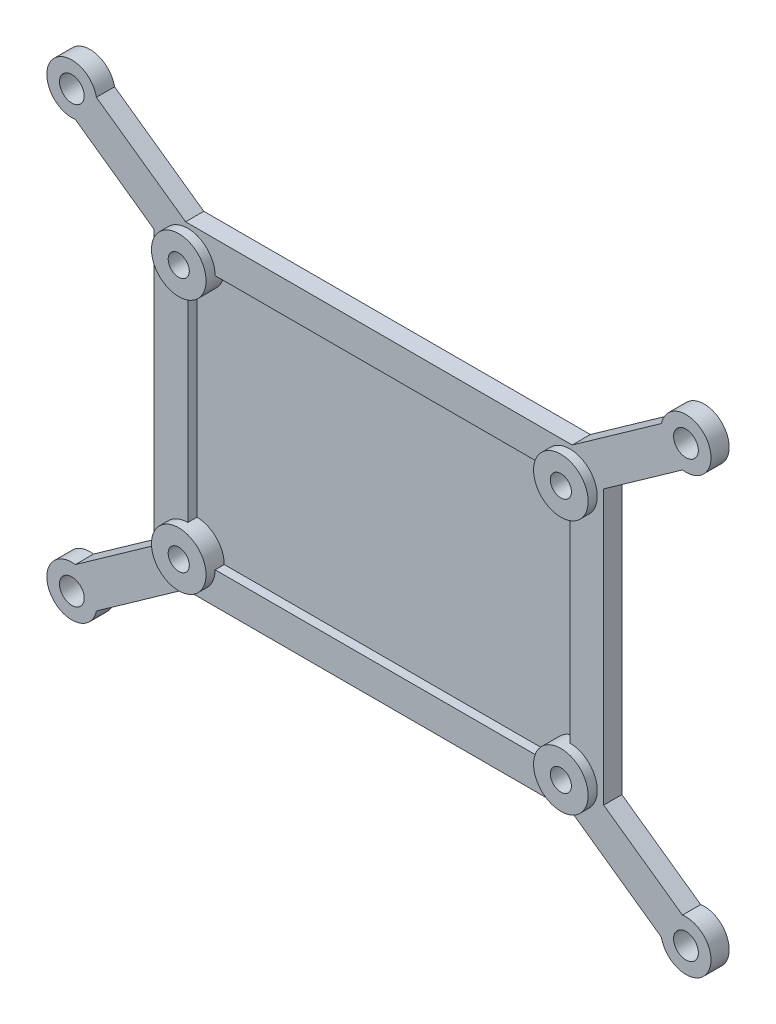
SolidWorks part; units mm, degrees
ref_plane "Front Plane" through (0, 0, 0) normal (0, 0, 1) x (1, 0, 0)
ref_plane "Top Plane" through (0, 0, 0) normal (0, 1, 0) x (1, 0, 0)
ref_plane "Right Plane" through (0, 0, 0) normal (1, 0, 0) x (0, 0, -1)
sketch "Sketch1" plane through (0, 0, 0) normal (0, 0, 1) x (1, 0, 0)
  line L0 (-42.8625, 30.3625) -> (42.8625, -30.3625) construction
  line L1 (42.8625, 30.3625) -> (-42.8625, -30.3625) construction
  line L2 (39.4382, 31.0496) -> (26.9807, 22.225)
  line L3 (-42.3747, 26.9042) -> (-31.3749, 19.1123)
  line L4 (42.3747, 26.9042) -> (31.3749, 19.1123)
  line L5 (-39.4382, 31.0496) -> (-26.9807, 22.225)
  line L6 (-44.3307, 28.2898) -> (41.3943, -32.4352) construction
  line L7 (-41.3943, 32.4352) -> (44.3307, -28.2898) construction
  line L8 (41.3943, 32.4352) -> (-44.3307, -28.2898) construction
  line L9 (44.3307, 28.2898) -> (-41.3943, -32.4352) construction
  line L10 (-31.3749, -19.1123) -> (-42.3747, -26.9042)
  line L11 (26.9807, -22.225) -> (39.4382, -31.0496)
  line L12 (31.3749, -19.1123) -> (42.3747, -26.9042)
  line L13 (-26.9807, -22.225) -> (-39.4382, -31.0496)
  line L15 (26.9807, -22.225) -> (-26.9807, -22.225)
  line L16 (31.3749, -19.1123) -> (31.3749, 19.1123)
  line L17 (26.9807, 22.225) -> (-26.9807, 22.225)
  line L18 (-31.3749, -19.1123) -> (-31.3749, 19.1123)
  line L19 (31.3749, -22.225) -> (-31.3749, 22.225) construction
  line L20 (31.3749, 22.225) -> (-31.3749, -22.225) construction
  arc A0 (-39.4382, 31.0496) -> (-42.3747, 26.9042) centre (-42.8625, 30.3625) ccw
  arc A1 (42.3747, 26.9042) -> (39.4382, 31.0496) centre (42.8625, 30.3625) ccw
  arc A2 (-42.3747, -26.9042) -> (-39.4382, -31.0496) centre (-42.8625, -30.3625) ccw
  arc A3 (39.4382, -31.0496) -> (42.3747, -26.9042) centre (42.8625, -30.3625) ccw
  circle A4 centre (-42.8625, 30.3625) radius 3.4925 construction
  point P26 (0, 0)
  dimension "D3" = 44.45
  dimension "D1" = 2.54
  dimension "D2" = 2.54
extrude "Boss-Extrude1" add sketch "Sketch1" along normal blind 2.54
hole_wizard "#4 Clearance Hole1" positions "Sketch3" profile "Sketch2" hole size "#4" standard "ANSI Inch"
sketch "Sketch3" plane through (0, 0, 2.54) normal (0, 0, 1) x (1, 0, 0)
  point P0 (-42.8625, 30.3625)
  point P3 (42.8625, 30.3625)
  point P6 (-42.8625, -30.3625)
  point P9 (42.8625, -30.3625)
sketch "Sketch2" plane through (-42.8625, 30.3625, 2.54) normal (1, 0, 0) x (0, -1, 0)
  line L0 (0, 0) -> (0, 7.3878)
  line L1 (0, 7.3878) -> (1.7272, 6.35)
  line L2 (1.7272, 6.35) -> (1.7272, 0)
  line L5 (1.7272, 0) -> (0, 0)
  line L10 (0, 7.3878) -> (-1.7272, 6.35) construction
  line L11 (0, -6.35) -> (0, 107.95) construction
  dimension "Hole Dia." = 3.4544
  dimension "Hole Depth" = 6.35
  dimension "Drill Angle" = 118
sketch "Sketch4" plane through (0, 0, 2.54) normal (0, 0, 1) x (1, 0, 0)
  line L5 (-26.67, 17.78) -> (26.67, 17.78) construction
  line L6 (-26.67, 17.78) -> (-26.67, -17.78) construction
  line L7 (-26.67, -17.78) -> (26.67, -17.78) construction
  line L8 (26.67, 17.78) -> (26.67, -17.78) construction
  circle A0 centre (-26.67, 17.78) radius 3.81
  circle A1 centre (-26.67, -17.78) radius 3.81
  circle A2 centre (26.67, -17.78) radius 3.81
  circle A3 centre (26.67, 17.78) radius 3.81
  point P8 (0, 17.78)
  point P9 (-26.67, 0)
  dimension "D1" = 7.62
  dimension "D2" = 53.34
  dimension "D3" = 35.56
extrude "Boss-Extrude2" add sketch "Sketch4" along normal blind 1.27
hole_wizard "#4 Clearance Hole2" positions "Sketch6" profile "Sketch7" hole size "#4" standard "ANSI Inch"
sketch "Sketch6" plane through (0, 0, 3.81) normal (0, 0, 1) x (1, 0, 0)
  point P0 (-26.67, 17.78)
  point P3 (-26.67, -17.78)
  point P6 (26.67, 17.78)
  point P9 (26.67, -17.78)
sketch "Sketch7" plane through (-26.67, 17.78, 3.81) normal (1, 0, 0) x (0, -1, 0)
  line L0 (0, 0) -> (0, 3.81)
  line L1 (0, 3.81) -> (1.4732, 3.81)
  line L2 (1.4732, 3.81) -> (1.4732, 0)
  line L5 (1.4732, 0) -> (0, 0)
  line L11 (0, -6.35) -> (0, 107.95) construction
  dimension "Thru Hole Dia." = 2.9464
  dimension "Thru Hole Depth" = 3.81
sketch "Sketch8" plane through (0, 0, 2.54) normal (0, 0, 1) x (1, 0, 0)
  line L1 (22.86, -17.78) -> (-22.86, -17.78)
  line L2 (26.67, -13.97) -> (26.67, 13.97)
  line L3 (22.86, 17.78) -> (-22.86, 17.78)
  line L4 (-26.67, -13.97) -> (-26.67, 13.97)
  line L5 (23.478, -15.6998) -> (-23.478, 15.6998) construction
  line L6 (23.478, 15.6998) -> (-23.478, -15.6998) construction
  circle A0 centre (-26.67, 17.78) radius 3.81 construction
  circle A1 centre (-26.67, -17.78) radius 3.81 construction
  circle A2 centre (26.67, -17.78) radius 3.81 construction
  circle A3 centre (26.67, 17.78) radius 3.81 construction
  arc A4 (-26.67, 13.97) -> (-22.86, 17.78) centre (-26.67, 17.78) ccw
  arc A5 (-22.86, -17.78) -> (-26.67, -13.97) centre (-26.67, -17.78) ccw
  arc A6 (26.67, -13.97) -> (22.86, -17.78) centre (26.67, -17.78) ccw
  arc A7 (22.86, 17.78) -> (26.67, 13.97) centre (26.67, 17.78) ccw
  point P0 (0, 0)
extrude "Cut-Extrude1" cut sketch "Sketch8" against normal offset from surface (1.27 mm away) 1.27
